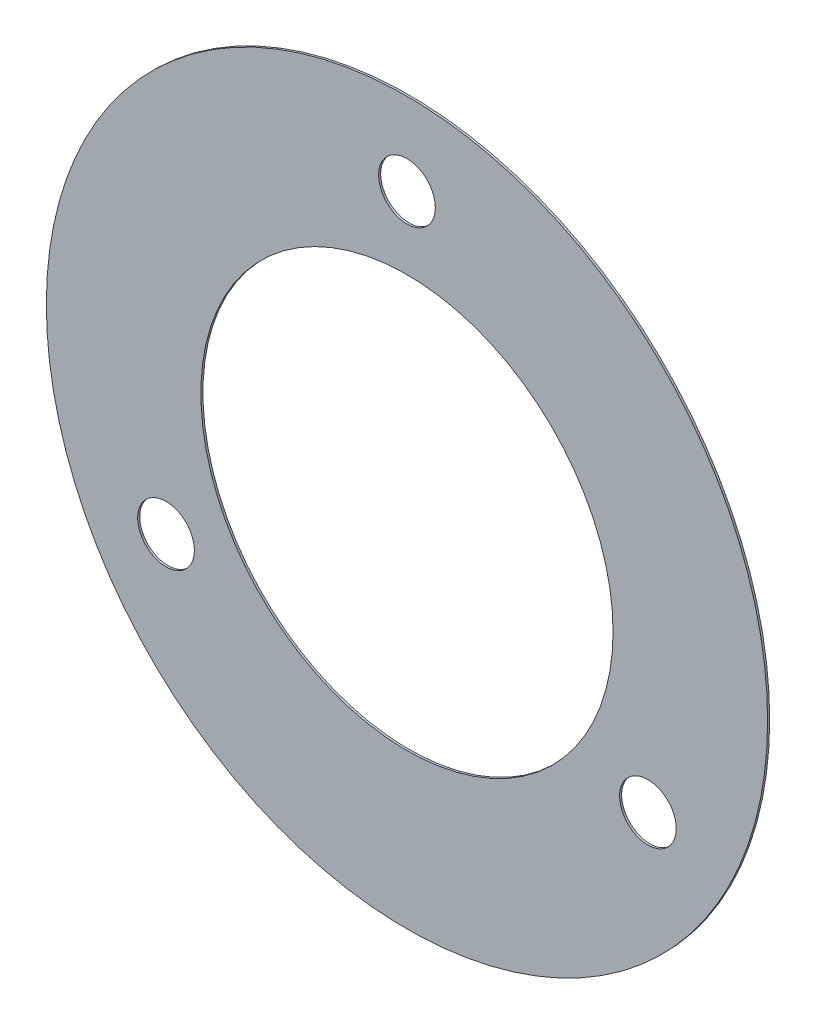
SolidWorks part; units mm, degrees
ref_plane "Plan de face" through (0, 0, 0) normal (0, 0, 1) x (1, 0, 0)
ref_plane "Plan de dessus" through (0, 0, 0) normal (0, 1, 0) x (1, 0, 0)
ref_plane "Plan de droite" through (0, 0, 0) normal (1, 0, 0) x (0, 0, -1)
sketch "Esquisse1" plane through (0, 0, 0) normal (0, 0, 1) x (1, 0, 0)
  circle A0 centre (0, 0) radius 40
  circle A1 centre (0, 0) radius 70
  dimension "D1" = 80
  dimension "D2" = 140
extrude "Extrusion1" add sketch "Esquisse1" along normal blind 0.4
sketch "Esquisse2" plane through (0, 0, 0.4) normal (0, 0, 1) x (1, 0, 0)
  line L0 (0, 65.1375) -> (0, 20.9899) construction
  circle A0 centre (0, 0) radius 54 construction
  circle A1 centre (0, 54) radius 5.5
  dimension "D1" = 108
  dimension "D2" = 11
extrude "Enlèv. mat.-Extru.1" cut sketch "Esquisse2" against normal through all
pattern_circular "Répétition circulaire1" count 3 over 360 about axis through (0, 0, 0) along (0, 0, 1) of "Enlèv. mat.-Extru.1"
